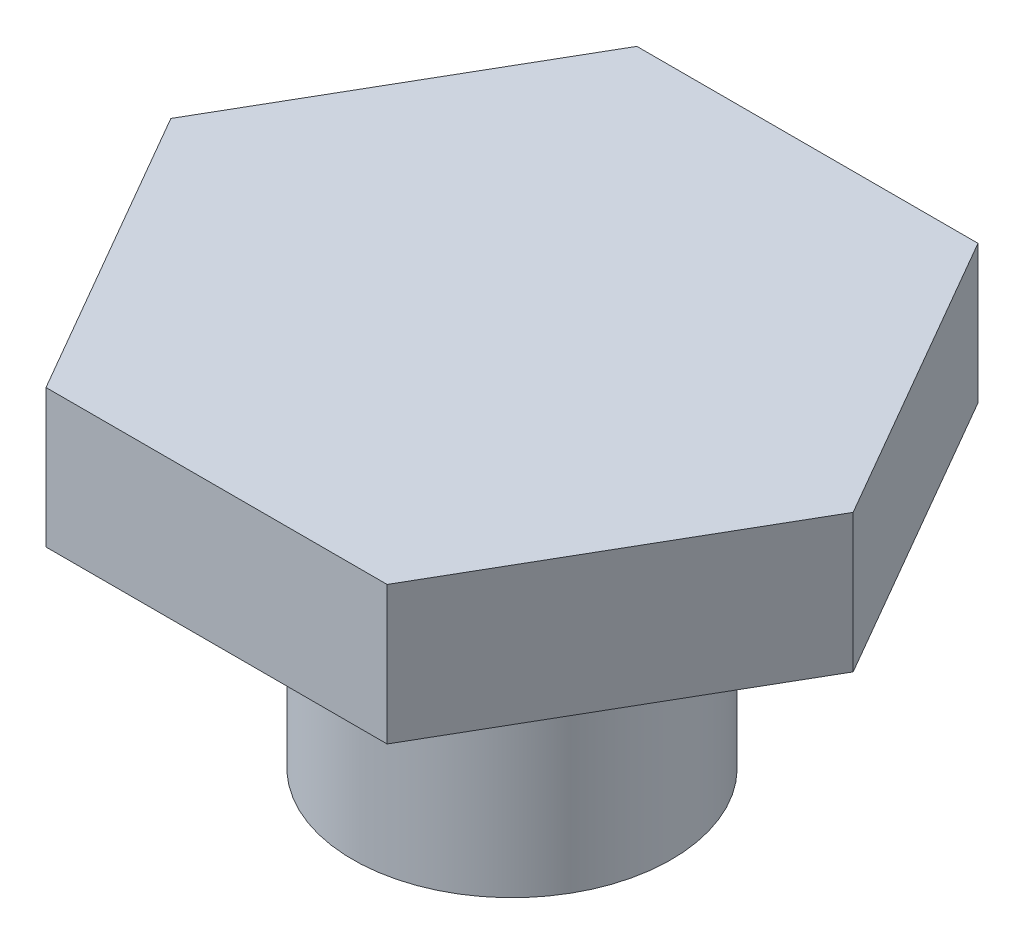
SolidWorks part; units mm, degrees
other "DetailItem1"
other "DetailItem2"
ref_plane "Front" through (0, 0, 0) normal (0, 0, 1) x (1, 0, 0)
ref_plane "Top" through (0, 0, 0) normal (0, 1, 0) x (1, 0, 0)
ref_plane "Right" through (0, 0, 0) normal (1, 0, 0) x (0, 0, -1)
sketch "Sketch6" plane through (0, 0, 0) normal (0, 0, 1) x (1, 0, 0)
  line L0 (0, 0) -> (0, 7.7684) construction
  line L1 (-5.5626, -7.052) -> (-5.5626, -1.2284) construction
  line L2 (0, -7.5946) -> (4.6228, -7.5946)
  line L3 (5.5626, -7.052) -> (5.5626, -1.2284)
  line L5 (4.6228, -0.6858) -> (4.6228, 1.5494)
  line L6 (4.6228, 1.5494) -> (6.9977, 1.5494)
  line L7 (6.9977, 1.5494) -> (6.9977, 2.8194)
  line L8 (6.9977, 2.8194) -> (9.5631, 2.8194)
  line L9 (9.5631, 2.8194) -> (9.5631, 1.8034)
  line L10 (9.5631, 1.8034) -> (10.3188, 1.8034)
  line L11 (10.3188, 1.8034) -> (10.3188, 6.6294)
  line L12 (10.3188, 6.6294) -> (0, 6.6294)
  line L14 (-4.6228, -0.6858) -> (-4.6228, 1.5494) construction
  line L15 (-6.9977, 1.5494) -> (-6.9977, 2.8194) construction
  line L16 (-10.3188, 1.8034) -> (-10.3188, 6.6294) construction
  line L17 (0, -7.5946) -> (0, 6.6294)
  line L18 (-9.5631, 2.8194) -> (-9.5631, 1.8034) construction
  line L20 (4.6228, -0.6858) -> (5.5626, -1.2284)
  line L21 (5.5626, -7.052) -> (4.6228, -7.5946)
  dimension "D2" = 9.2456
  dimension "D3" = 13.9954
  dimension "D4" = 20.6375
  dimension "D5" = 9.144
  dimension "D6" = 2.2352
  dimension "D7" = 0.254
  dimension "D8" = 1.27
  dimension "D9" = 2.5654
  dimension "D10" = 5.08
  dimension "D11" = 19.1262
  dimension "D12" = 6.9088
  dimension "D13" = 30
  dimension "D14" = 120
  dimension "D15" = 11.1252
revolve "Revolve1" add sketch "Sketch6" angle 360 about L0
sketch "Sketch8" plane through (0, 1.8034, 0) normal (0, -1, 0) x (1, 0, 0)
  line L1 (5.9575, -10.3188) -> (11.9151, 0)
  line L2 (11.9151, 0) -> (5.9575, 10.3188)
  line L3 (5.9575, 10.3188) -> (-5.9575, 10.3188)
  line L4 (-5.9575, 10.3188) -> (-11.9151, 0)
  line L5 (-11.9151, 0) -> (-5.9575, -10.3188)
  line L6 (-5.9575, -10.3188) -> (5.9575, -10.3188)
  circle A0 centre (0, 0) radius 10.3187 construction
  circle A1 centre (0, 0) radius 9.9225
  dimension "D1" = 20.6375
extrude "Hex" add sketch "Sketch8" against normal up to surface (4.826 mm away)
sketch "Sketch10" plane through (0, 6.6294, 0) normal (0, 1, 0) x (-1, 0, 0)
  circle A0 centre (0, 0) radius 20.3098
